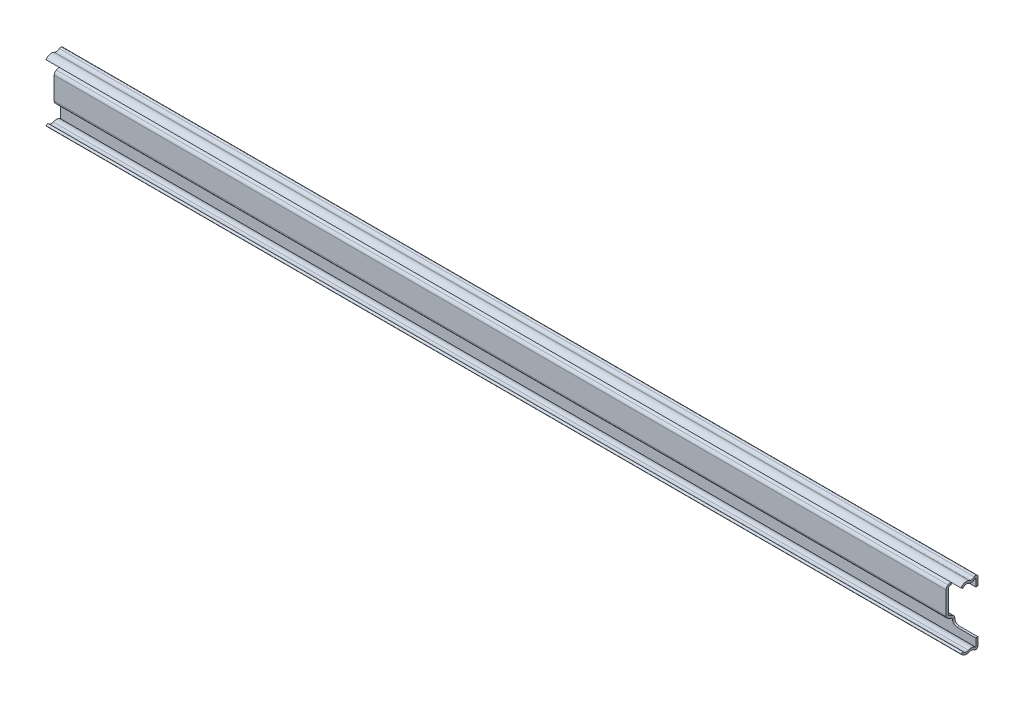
SolidWorks part; units mm, degrees
ref_plane "Front Plane" through (0, 0, 0) normal (0, 0, 1) x (1, 0, 0)
ref_plane "Top Plane" through (0, 0, 0) normal (0, 1, 0) x (1, 0, 0)
ref_plane "Right Plane" through (0, 0, 0) normal (1, 0, 0) x (0, 0, -1)
ref_plane "Plane1" through (-3.937, 0, 0) normal (1, 0, 0) x (0, 0, -1)
sketch "Sketch1" plane through (-3.937, 0, 0) normal (1, 0, 0) x (0, 0, -1)
  line L0 (2.3114, 16.3766) -> (2.3114, -16.3766)
  line L1 (-4.7105, -14.9753) -> (-5.7404, -15.6277)
  line L2 (3.5306, -16.3766) -> (3.5306, 16.3766)
  line L3 (-5.7404, 15.6277) -> (-4.7105, 14.9753)
  arc A0 (2.3114, -16.3766) -> (-1.7707, -15.816) centre (-0.1524, -19.1744) ccw
  arc A1 (-1.7707, -15.816) -> (-4.7105, -14.9753) centre (-2.7686, -13.7451) cw
  arc A2 (-5.7404, -15.6277) -> (-1.2415, -16.9143) centre (-2.7686, -13.7451) ccw
  arc A3 (-1.2415, -16.9143) -> (1.5056, -17.2916) centre (-0.1524, -19.1744) cw
  arc A4 (1.5056, -17.2916) -> (3.5306, -16.3766) centre (2.3114, -16.3766) ccw
  arc A5 (3.5306, 16.3766) -> (1.5056, 17.2916) centre (2.3114, 16.3766) ccw
  arc A6 (1.5056, 17.2916) -> (-1.2415, 16.9143) centre (-0.1524, 19.1744) cw
  arc A7 (-1.2415, 16.9143) -> (-5.7404, 15.6277) centre (-2.7686, 13.7451) ccw
  arc A8 (-4.7105, 14.9753) -> (-1.7707, 15.816) centre (-2.7686, 13.7451) cw
  arc A9 (-1.7707, 15.816) -> (2.3114, 16.3766) centre (-0.1524, 19.1744) ccw
  dimension "D1" = 3.728
  dimension "D2" = 2.2987
  dimension "D3" = 3.5179
  dimension "D4" = 1.2192
  dimension "D5" = 2.025
  dimension "D6" = 4.7721
  dimension "D7" = 8.2411
  dimension "D8" = 9.271
  dimension "D9" = 32.9195
  dimension "D10" = 34.1496
extrude "Boss-Extrude1" add sketch "Sketch1" against normal blind 500.126
sketch "Sketch2" plane through (0, 0, -3.5306) normal (0, 0, -1) x (-1, 0, 0)
  line L0 (3.937, 12.065) -> (3.937, -12.065)
  line L1 (3.937, -12.065) -> (16.637, -12.065)
  line L2 (16.637, -12.065) -> (16.637, 12.065)
  line L3 (16.637, 12.065) -> (3.937, 12.065)
  line L4 (3.937, -16.3766) -> (3.937, 16.3766) construction
  line L5 (504.063, -16.3766) -> (3.937, -16.3766) construction
  dimension "D1" = 12.7
  dimension "D2" = 4.3116
  dimension "D3" = 28.4416
extrude "Cut-Extrude1" cut sketch "Sketch2" against normal through all
sketch "Sketch3" plane through (0, 0, -2.3114) normal (0, 0, 1) x (1, 0, 0)
  line L0 (-504.063, -7.3781) -> (-504.063, 7.3781)
  line L1 (-504.063, 7.3781) -> (-16.637, 7.3781)
  line L2 (-16.637, 7.3781) -> (-16.637, -7.3781)
  line L3 (-16.637, -7.3781) -> (-504.063, -7.3781)
  line L4 (-504.063, 16.3766) -> (-504.063, -16.3766) construction
  line L5 (-504.063, 16.3766) -> (-3.937, 16.3766) construction
  dimension "D1" = 487.426
  dimension "D2" = 8.9985
  dimension "D3" = 23.7547
extrude "Boss-Extrude2" add sketch "Sketch3" along normal blind 3.556
sketch "Sketch4" plane through (-504.063, 0, 0) normal (-1, 0, 0) x (0, 0, 1)
  line L0 (-3.5306, 6.6014) -> (-3.5306, -6.6014)
  line L1 (-3.5306, -6.6014) -> (0.0254, -6.6014)
  line L2 (0.0254, -6.6014) -> (0.0254, 6.6014)
  line L3 (0.0254, 6.6014) -> (-3.5306, 6.6014)
  line L4 (-3.5306, -16.3766) -> (-3.5306, 16.3766) construction
  dimension "D1" = 3.556
  dimension "D2" = 10.6902
  dimension "D3" = 23.8929
extrude "Cut-Extrude2" cut sketch "Sketch4" against normal through all
draft "Draft1" type of draft neutral plane draft angle 25 faces to draft 2 parameters "D1"=25
draft "Draft2" type of draft neutral plane draft angle 25 faces to draft 2 parameters "D1"=25
fillet "Fillet1" radius 0.762 4 edges at (-260.35, 6.6014, 0.0254) (-260.35, -6.6014, 0.0254) (-260.35, 9.0363, -2.3114) (-260.35, -9.0363, -2.3114)
fillet "Fillet2" radius 1.9812 4 edges at (-260.35, 8.2596, -3.5306) (-260.35, 7.3781, 1.2446) (-260.35, -7.3781, 1.2446) (-260.35, -8.2596, -3.5306)
fillet "Fillet3" radius 2.54 2 edges at (-16.637, -12.065, -2.921) (-16.637, 12.065, -2.921)
